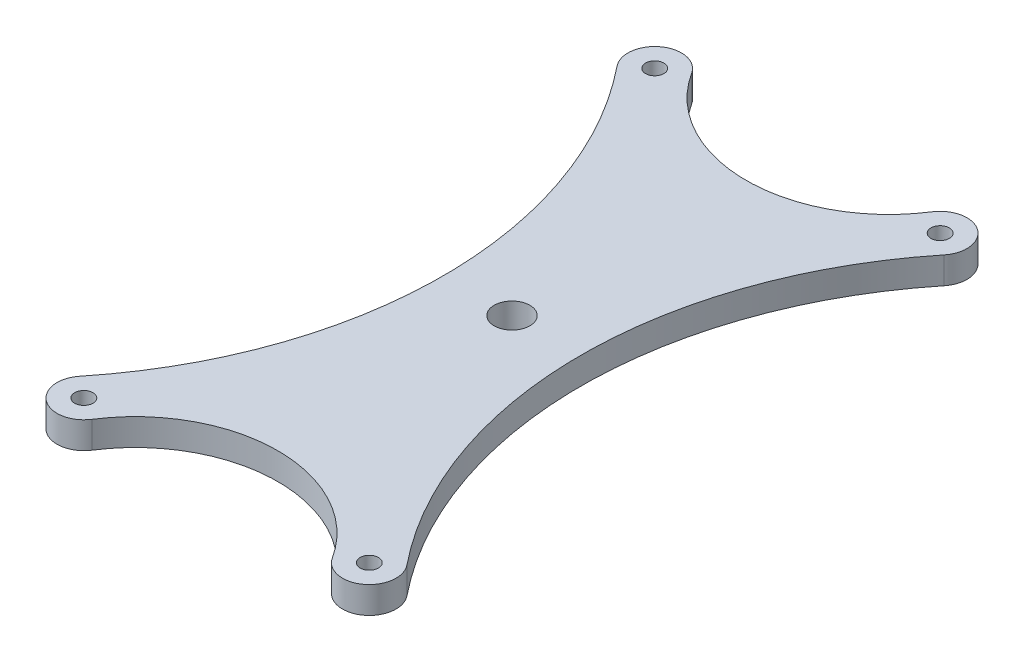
SolidWorks part; units mm, degrees
ref_plane "Front Plane" through (0, 0, 0) normal (0, 0, 1) x (1, 0, 0)
ref_plane "Top Plane" through (0, 0, 0) normal (0, 1, 0) x (1, 0, 0)
ref_plane "Right Plane" through (0, 0, 0) normal (1, 0, 0) x (0, 0, -1)
sketch "Sketch1" plane through (0, 0, 0) normal (0, 1, 0) x (1, 0, 0)
  line L1 (-50.8, 101.6) -> (50.8, 101.6) construction
  line L2 (-50.8, 101.6) -> (-50.8, -101.6) construction
  line L3 (-50.8, -101.6) -> (50.8, -101.6) construction
  line L4 (50.8, 101.6) -> (50.8, -101.6) construction
  line L5 (-50.8, 101.6) -> (50.8, -101.6) construction
  line L6 (-50.8, -101.6) -> (50.8, 101.6) construction
  circle A0 centre (-50.8, 101.6) radius 3.2639
  circle A1 centre (50.8, 101.6) radius 3.2639
  circle A2 centre (-50.8, -101.6) radius 3.2639
  circle A3 centre (50.8, -101.6) radius 3.2639
  circle A8 centre (0, 0) radius 6.35
  arc A9 (-42.7789, 106.737) -> (-58.2167, 95.6235) centre (-50.8, 101.6) ccw
  arc A10 (58.2167, 95.6235) -> (42.7789, 106.737) centre (50.8, 101.6) ccw
  arc A11 (42.7789, -106.737) -> (58.2167, -95.6235) centre (50.8, -101.6) ccw
  arc A12 (-58.2167, -95.6235) -> (-42.7789, -106.737) centre (-50.8, -101.6) ccw
  arc A13 (-58.2167, 95.6235) -> (-58.2167, -95.6235) centre (-176.8839, 0) cw
  arc A14 (58.2167, 95.6235) -> (58.2167, -95.6235) centre (176.8839, 0) ccw
  arc A15 (-42.7789, 106.737) -> (42.7789, 106.737) centre (0, 134.1341) ccw
  arc A16 (-42.7789, -106.737) -> (42.7789, -106.737) centre (0, -134.1341) cw
  point P0 (0, 0)
  point P10 (0, 0)
  point P29 (0, 0)
  dimension "D1" = 6.5278
  dimension "D4" = 19.05
  dimension "D7" = 12.7
  dimension "D5" = 152.4
  dimension "D6" = 50.8
  dimension "D2" = 101.6
  dimension "D3" = 203.2
extrude "Boss-Extrude1" add sketch "Sketch1" along normal blind 9.525
